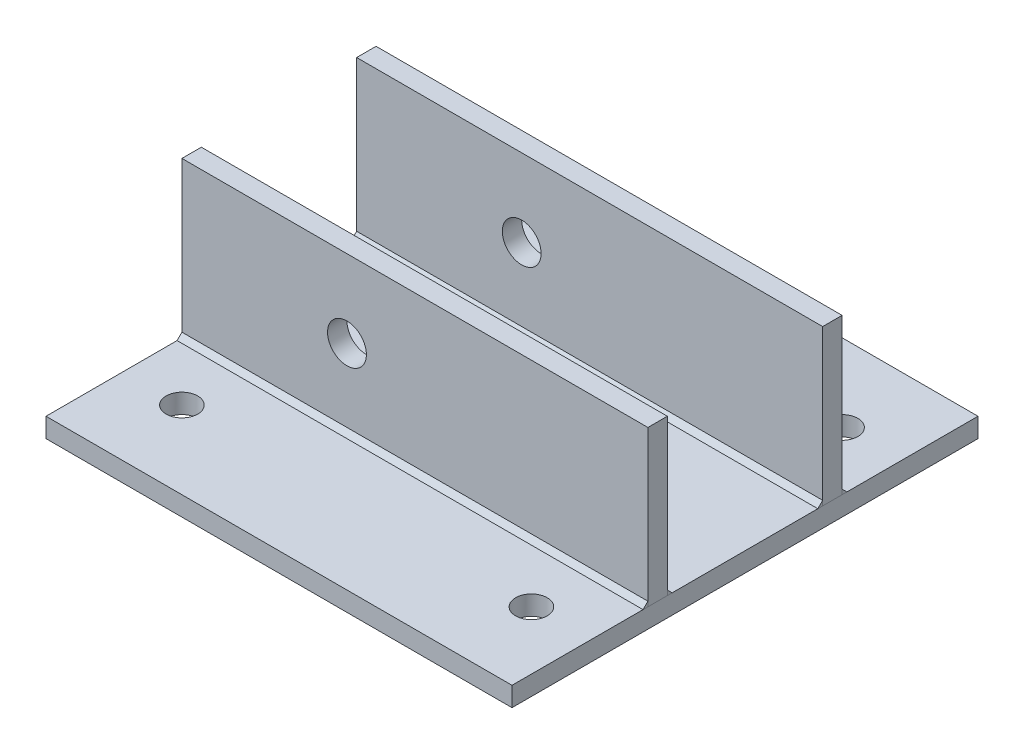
SolidWorks part; units mm, degrees
other "DetailItem2"
other "DetailItem3"
ref_plane "Front Plane" through (0, 0, 0) normal (0, 0, 1) x (1, 0, 0)
ref_plane "Top Plane" through (0, 0, 0) normal (0, 1, 0) x (1, 0, 0)
ref_plane "Right Plane" through (0, 0, 0) normal (1, 0, 0) x (0, 0, -1)
sketch "Sketch1" plane through (0, 0, 0) normal (0, 1, 0) x (1, 0, 0)
  line L1 (0, 0) -> (-304.8, 0)
  line L2 (0, 0) -> (0, -304.8)
  line L3 (0, -304.8) -> (-304.8, -304.8)
  line L4 (-304.8, 0) -> (-304.8, -304.8)
  dimension "D1" = 304.8
extrude "Extrude1" add sketch "Sketch1" along normal blind 12.7
sketch "Sketch2" plane through (0, 12.7, 0) normal (0, 1, 0) x (1, 0, 0)
  line L0 (-304.8, 0) -> (-304.8, -304.8) construction
  line L1 (-304.8, -101.6) -> (0, -101.6)
  line L2 (-304.8, -101.6) -> (-304.8, -88.9)
  line L3 (-304.8, -88.9) -> (0, -88.9)
  line L4 (0, -101.6) -> (0, -88.9)
  line L5 (0, -304.8) -> (0, 0) construction
  line L7 (-304.8, -203.2) -> (0, -203.2)
  line L8 (-304.8, -203.2) -> (-304.8, -215.9)
  line L9 (-304.8, -215.9) -> (0, -215.9)
  line L10 (0, -203.2) -> (0, -215.9)
  dimension "D1" = 88.9
  dimension "D2" = 101.6
  dimension "D3" = 203.2
extrude "Extrude2" add sketch "Sketch2" along normal blind 101.6 separate body
other "Fillet Bead2" parameters "D10"=6.35, "D11"=3.175, "D12"=0, "D13"=3.175, "D14"=0
other "Fillet Bead3" parameters "D10"=6.35, "D11"=3.175, "D12"=0, "D13"=3.175, "D14"=0
sketch "Sketch3" plane through (0, 12.7, 0) normal (0, 1, 0) x (1, 0, 0)
  line L0 (0, -304.8) -> (0, 0) construction
  circle A0 centre (-266.7, -50.8) radius 10.3187
  circle A1 centre (-266.7, -254) radius 10.3187
  circle A2 centre (-38.1, -50.8) radius 10.3188
  circle A3 centre (-38.1, -254) radius 10.3188
  dimension "D1" = 20.6375
  dimension "D6" = 38.1
  dimension "D2" = 266.7
  dimension "D3" = 266.7
  dimension "D4" = 50.8
  dimension "D5" = 254
  dimension "D7" = 38.1
extrude "Cut-Extrude1" cut sketch "Sketch3" against normal up to next
sketch "Sketch4" plane through (0, 0, 215.9) normal (0, 0, 1) x (1, 0, 0)
  line L0 (0, 114.3) -> (0, 12.7) construction
  line L1 (-304.8, 114.3) -> (0, 114.3) construction
  circle A0 centre (-196.85, 63.5) radius 12.7
  dimension "D1" = 25.4
  dimension "D2" = 196.85
  dimension "D3" = 50.8
extrude "Cut-Extrude2" cut sketch "Sketch4" against normal up to surface (127 mm away)
